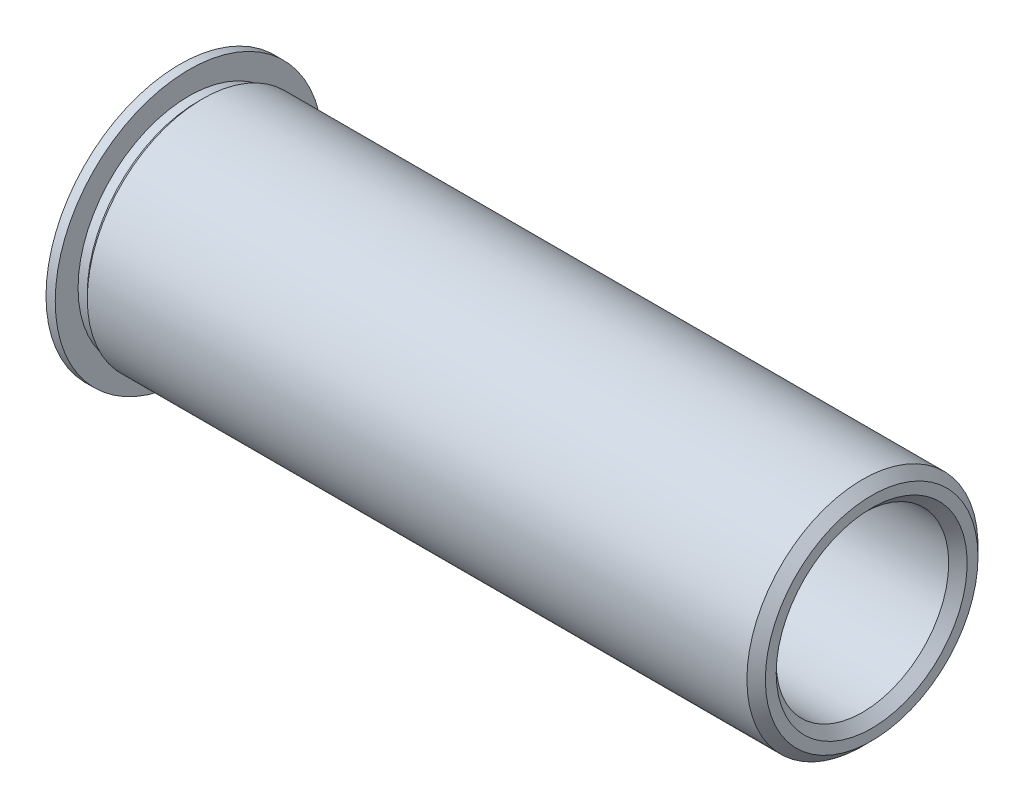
SolidWorks part; units mm, degrees
ref_plane "Front Plane" through (0, 0, 0) normal (0, 0, 1) x (1, 0, 0)
ref_plane "Top Plane" through (0, 0, 0) normal (0, 1, 0) x (1, 0, 0)
ref_plane "Right Plane" through (0, 0, 0) normal (1, 0, 0) x (0, 0, -1)
sketch "Sketch2" plane through (0, 0, 0) normal (0, 0, 1) x (1, 0, 0)
  line L0 (-64.1411, 95.4401) -> (-64.1411, 99.1231)
  line L1 (-64.1411, 99.1231) -> (-63.8871, 99.1231)
  line L2 (-64.1411, 95.4401) -> (-45.0911, 95.4401)
  line L3 (-45.0911, 95.4401) -> (-45.0911, 98.3674)
  line L4 (-45.0911, 98.3674) -> (-45.3451, 98.6214)
  line L5 (-45.3451, 98.6214) -> (-63.5061, 98.6214)
  line L6 (-63.5061, 98.6214) -> (-63.6331, 98.4944)
  line L7 (-63.6331, 98.4944) -> (-63.8871, 98.4944)
  line L8 (-63.8871, 98.4944) -> (-63.8871, 99.1231)
  dimension "D1" = 3.683
  dimension "D2" = 0.254
  dimension "D3" = 3.1813
  dimension "D4" = 0.254
  dimension "D5" = 0.254
  dimension "D6" = 19.05
  dimension "D7" = 0.127
  dimension "D8" = 0.254
revolve "Revolve3" add sketch "Sketch2" angle 360 about L2
sketch "Sketch3" plane through (-45.0911, 0, 0) normal (1, 0, 0) x (0, 0, -1)
  circle A0 centre (0, 95.4401) radius 2.3749
  dimension "D1" = 4.7498
extrude "Cut-Extrude1" cut sketch "Sketch3" against normal through all
chamfer "Chamfer2" distance 0.254 angle 45 1 edges at (-64.1411, 95.4401, -2.3749)
chamfer "Chamfer3" distance 0.254 angle 45 1 edges at (-45.0911, 95.4401, -2.3749)
